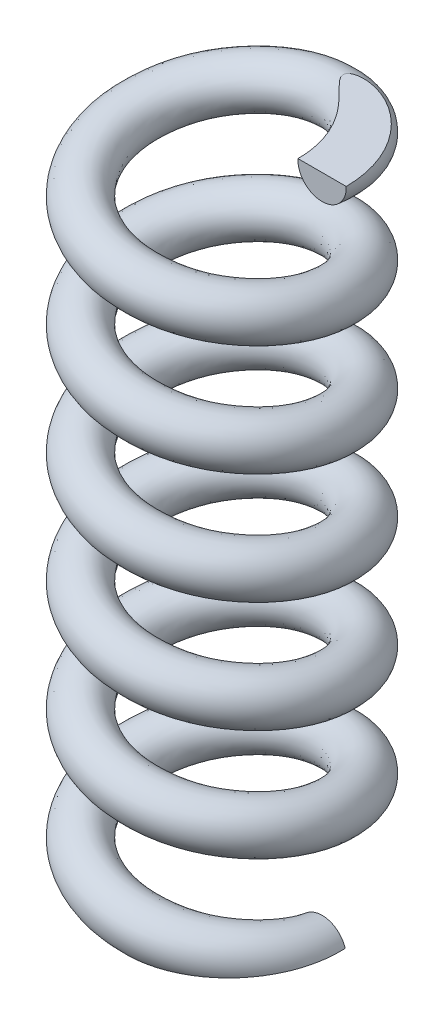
SolidWorks part; units mm, degrees
ref_plane "Front Plane" through (0, 0, 0) normal (0, 0, 1) x (1, 0, 0)
ref_plane "Top Plane" through (0, 0, 0) normal (0, 1, 0) x (1, 0, 0)
ref_plane "Right Plane" through (0, 0, 0) normal (1, 0, 0) x (0, 0, -1)
sketch "Sketch1" plane through (0, 0, 0) normal (0, 0, 1) x (1, 0, 0)
  line L0 (0, 36.8487) -> (0, -63.0513)
sketch "Sketch2" plane through (0, 0, 0) normal (0, 0, 1) x (1, 0, 0)
  line L0 (0, 36.8487) -> (0, -63.0513) construction
  circle A0 centre (15, -63.0513) radius 3.625
  dimension "D2" = 7.25
  dimension "D1" = 15
sweep "Sweep1" add profiles "Sketch2" path "Sketch1" parameters "D4"=2160
ref_plane "Plane1" through (0, 37, 0) normal (0, 1, 0) x (1, 0, 0)
sketch "Sketch4" plane through (0, 37, 0) normal (0, 1, 0) x (1, 0, 0)
  circle A0 centre (0, 0) radius 21.2633
extrude "Cut-Extrude1" cut sketch "Sketch4" along normal blind 10
ref_plane "Plane2" through (0, -62, 0) normal (0, 1, 0) x (1, 0, 0)
sketch "Sketch5" plane through (0, -62, 0) normal (0, 1, 0) x (1, 0, 0)
  circle A0 centre (0, 0) radius 20.867
extrude "Cut-Extrude2" cut sketch "Sketch5" against normal blind 10
